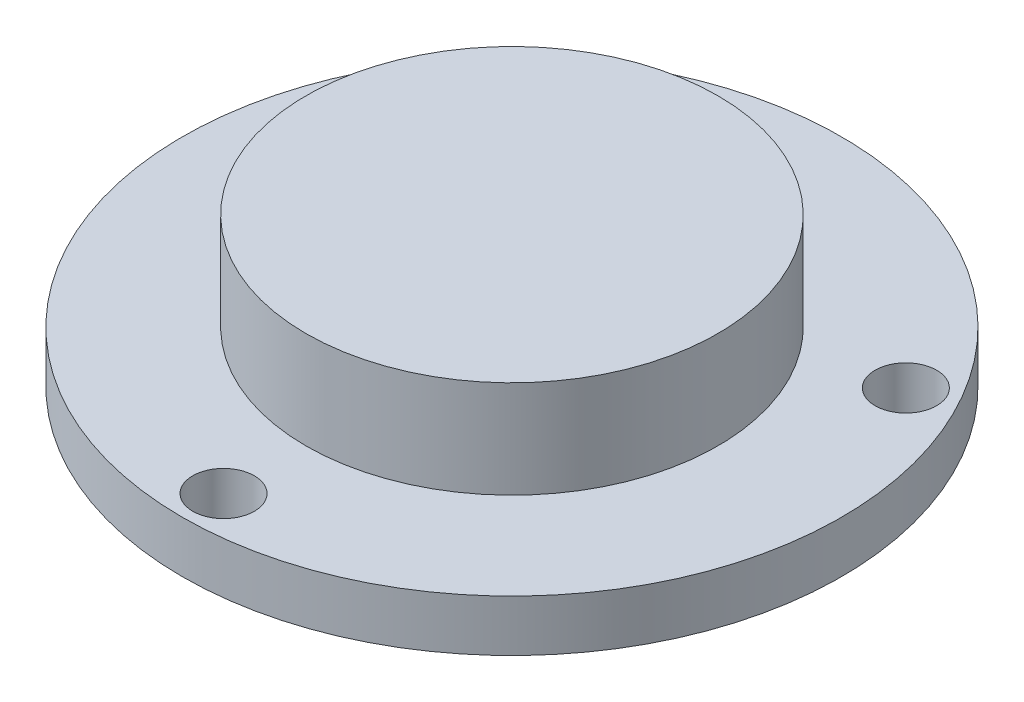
SolidWorks part; units mm, degrees
ref_plane "Front Plane" through (0, 0, 0) normal (0, 0, 1) x (1, 0, 0)
ref_plane "Top Plane" through (0, 0, 0) normal (0, 1, 0) x (1, 0, 0)
ref_plane "Right Plane" through (0, 0, 0) normal (1, 0, 0) x (0, 0, -1)
sketch "Sketch1" plane through (0, 0, 0) normal (0, 1, 0) x (1, 0, 0)
  circle A0 centre (0, 0) radius 20.32
  dimension "D1" = 40.64
extrude "Boss-Extrude1" add sketch "Sketch1" along normal blind 3.175
sketch "Sketch2" plane through (0, 3.175, 0) normal (0, 1, 0) x (1, 0, 0)
  circle A0 centre (0, 0) radius 12.7
  dimension "D1" = 25.4
extrude "Boss-Extrude2" add sketch "Sketch2" along normal blind 6
hole_wizard "#6 Clearance Hole1" positions "Sketch4" profile "Sketch3" hole size "#6" standard "ANSI Inch"
sketch "Sketch4" plane through (0, 3.175, 0) normal (0, 1, 0) x (1, 0, 0)
  line L0 (0, -17.78) -> (0, 0) construction
  point P0 (0, -17.78)
  dimension "D1" = 17.78
sketch "Sketch3" plane through (0, 3.175, 17.78) normal (1, 0, 0) x (0, 0, 1)
  line L0 (0, 0) -> (0, 3.175)
  line L1 (0, 3.175) -> (1.8986, 3.175)
  line L2 (1.8986, 3.175) -> (1.8986, 0)
  line L5 (1.8986, 0) -> (0, 0)
  line L11 (0, -6.35) -> (0, 107.95) construction
  dimension "Thru Hole Dia." = 3.7973
  dimension "Thru Hole Depth" = 3.175
pattern_circular "CirPattern1" count 3 every 120 about axis through (0, 0, 0) along (0, 1, 0) of "#6 Clearance Hole1"
